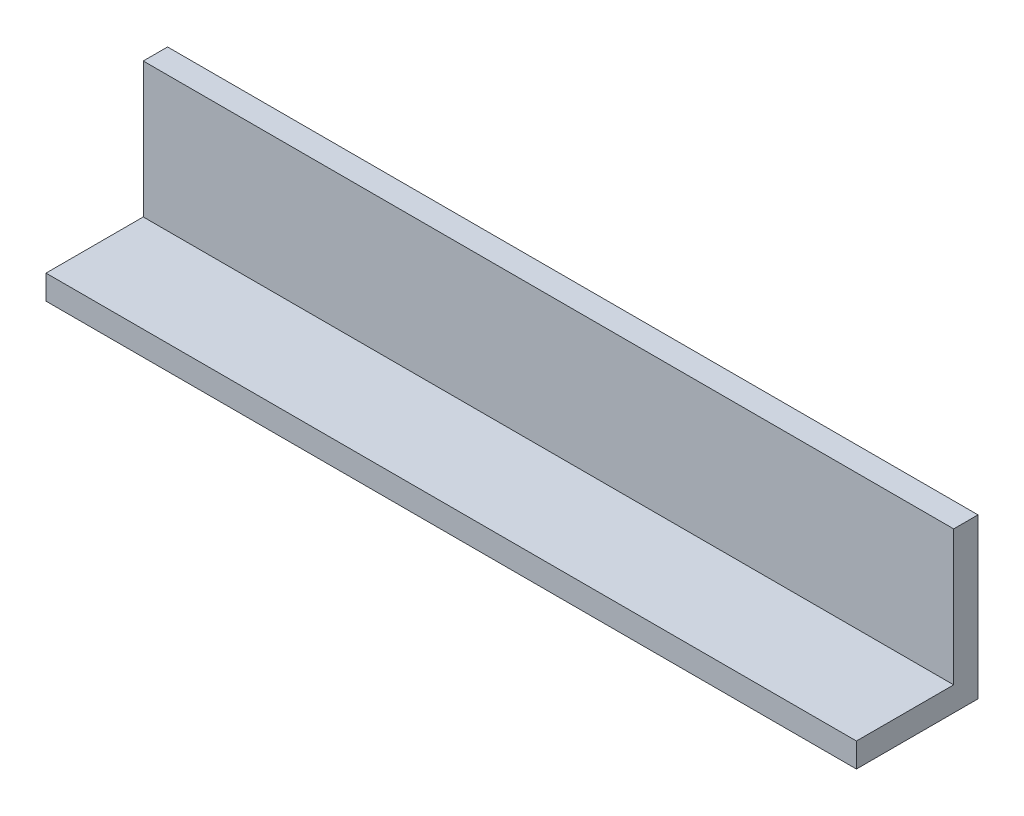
SolidWorks part; units mm, degrees
ref_plane "Plano frontal" through (0, 0, 0) normal (0, 0, 1) x (1, 0, 0)
ref_plane "Plano superior" through (0, 0, 0) normal (0, 1, 0) x (1, 0, 0)
ref_plane "Plano direito" through (0, 0, 0) normal (1, 0, 0) x (0, 0, -1)
sketch "Esboço2" plane through (0, 0, 0) normal (0, 0, 1) x (1, 0, 0)
  line L0 (-1000, 0) -> (49000, 0) construction
  line L1 (-1000, -100) -> (49000, -100) construction
  line L2 (0.0497, -997.0011) -> (0.0497, 49002.9989) construction
  line L3 (-299.9503, -997.0011) -> (-299.9503, 49002.9989) construction
  line L4 (300.0497, -997.0011) -> (300.0497, 49002.9989) construction
  line L6 (-299.9503, 0) -> (300.0497, 0)
  line L7 (-299.9503, 0) -> (-299.9503, -100)
  line L8 (-299.9503, -100) -> (300.0497, -100)
  line L9 (300.0497, 0) -> (300.0497, -100)
  line L10 (-299.9503, 0) -> (300.0497, -100) construction
  line L11 (-299.9503, -100) -> (300.0497, 0) construction
  point P15 (0.0497, -50)
  dimension "D1" = 100
  dimension "D2" = 300
  dimension "D3" = 300
extrude "Ressalto-extrusão1" add sketch "Esboço2" along normal blind 18
sketch "Esboço3" plane through (0, -100, 0) normal (0, 1, 0) x (1, 0, 0)
  line L0 (-299.9503, -1006.2232) -> (-299.9503, 48993.7768) construction
  line L2 (300.0497, -1009) -> (300.0497, 48991) construction
  line L3 (300.0497, -18) -> (300.0497, 0) construction
  line L4 (-1299.9503, 0) -> (48700.0497, 0) construction
  line L5 (-1299.9503, -90) -> (48700.0497, -90) construction
  line L7 (-299.9503, 0) -> (300.0497, 0)
  line L8 (-299.9503, 0) -> (-299.9503, -90)
  line L9 (-299.9503, -90) -> (300.0497, -90)
  line L10 (300.0497, 0) -> (300.0497, -90)
  line L11 (-299.9503, 0) -> (300.0497, -90) construction
  line L12 (-299.9503, -90) -> (300.0497, 0) construction
  point P7 (300.0497, -9)
  point P16 (0.0497, -45)
  dimension "D1" = 90
extrude "Ressalto-extrusão2" add sketch "Esboço3" against normal blind 18
